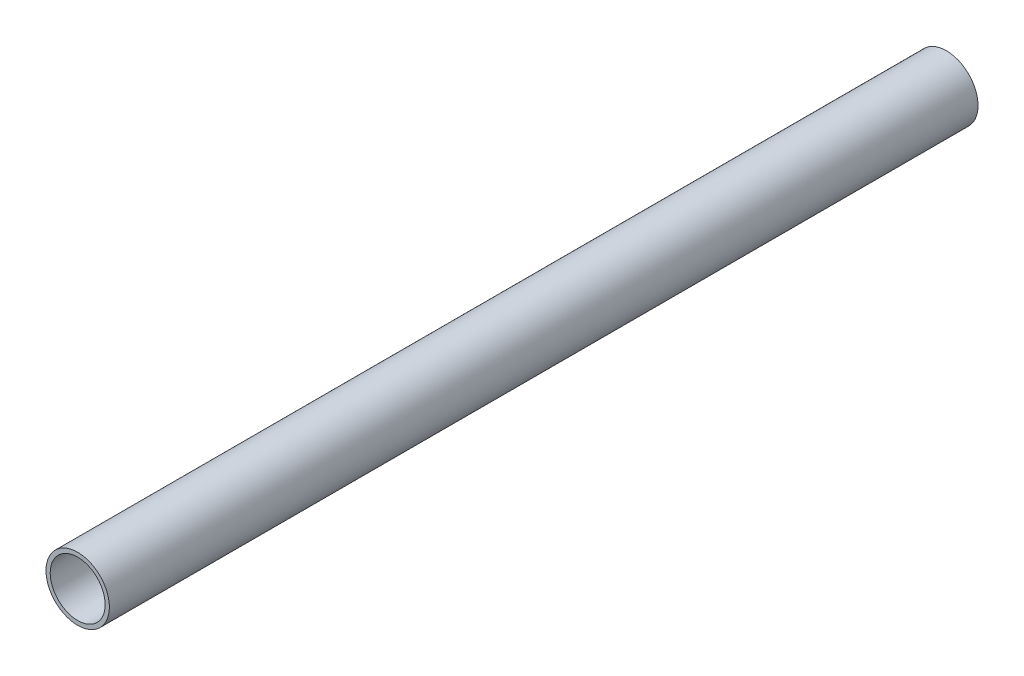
SolidWorks part; units mm, degrees
ref_plane "Front Plane" through (0, 0, 0) normal (0, 0, 1) x (1, 0, 0)
ref_plane "Top Plane" through (0, 0, 0) normal (0, 1, 0) x (1, 0, 0)
ref_plane "Right Plane" through (0, 0, 0) normal (1, 0, 0) x (0, 0, -1)
sketch "Sketch1" plane through (0, 0, 0) normal (0, 0, 1) x (1, 0, 0)
  circle A0 centre (0, 0) radius 11.1125
  dimension "D1" = 22.225
extrude "Extrude-Thin1" add sketch "Sketch1" along normal blind 304.8 thin
